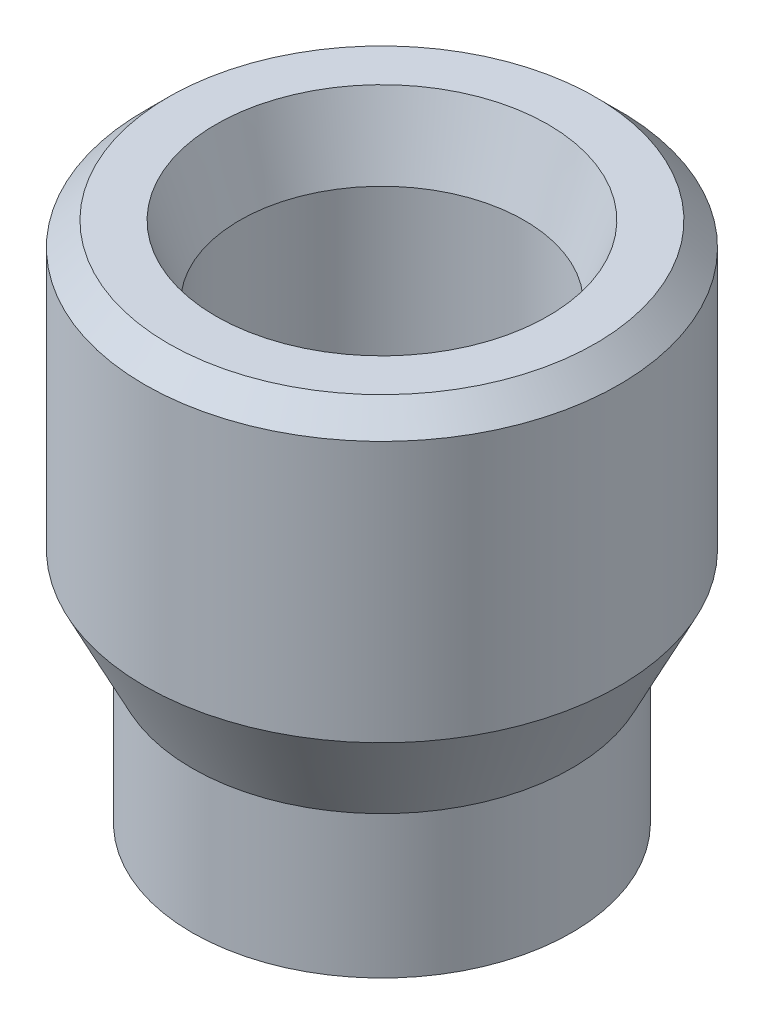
SolidWorks part; units mm, degrees
ref_plane "Přední rovina" through (0, 0, 0) normal (0, 0, 1) x (1, 0, 0)
ref_plane "Horní rovina" through (0, 0, 0) normal (0, 1, 0) x (1, 0, 0)
ref_plane "Pravá rovina" through (0, 0, 0) normal (1, 0, 0) x (0, 0, -1)
sketch "Skica1" plane through (0, 0, 0) normal (0, 1, 0) x (1, 0, 0)
  circle A0 centre (0, 0) radius 8
extrude "Přidat vysunutím1" add sketch "Skica1" along normal blind 10
sketch "Skica2" plane through (0, 10, 0) normal (0, 1, 0) x (-1, 0, 0)
  circle A0 centre (0, 0) radius 10
extrude "Přidat vysunutím2" add sketch "Skica2" along normal blind 12
chamfer "Zkosení1" distance 4 distance2 2 1 edges at (0, 10, 8)
chamfer "Zkosení2" distance 1 distance2 1 1 edges at (0, 22, 10)
sketch "Skica3" plane through (0, 0, 0) normal (0, -1, 0) x (1, 0, 0)
  circle A0 centre (0, 0) radius 3.5
extrude "Odebrat vysunutím1" cut sketch "Skica3" against normal blind 11
sketch "Skica4" plane through (0, 22, 0) normal (0, 1, 0) x (-1, 0, 0)
  circle A0 centre (0, 0) radius 6
extrude "Odebrat vysunutím2" cut sketch "Skica4" against normal blind 11
chamfer "Zkosení3" distance 1 distance2 3 1 edges at (0, 22, 6)
